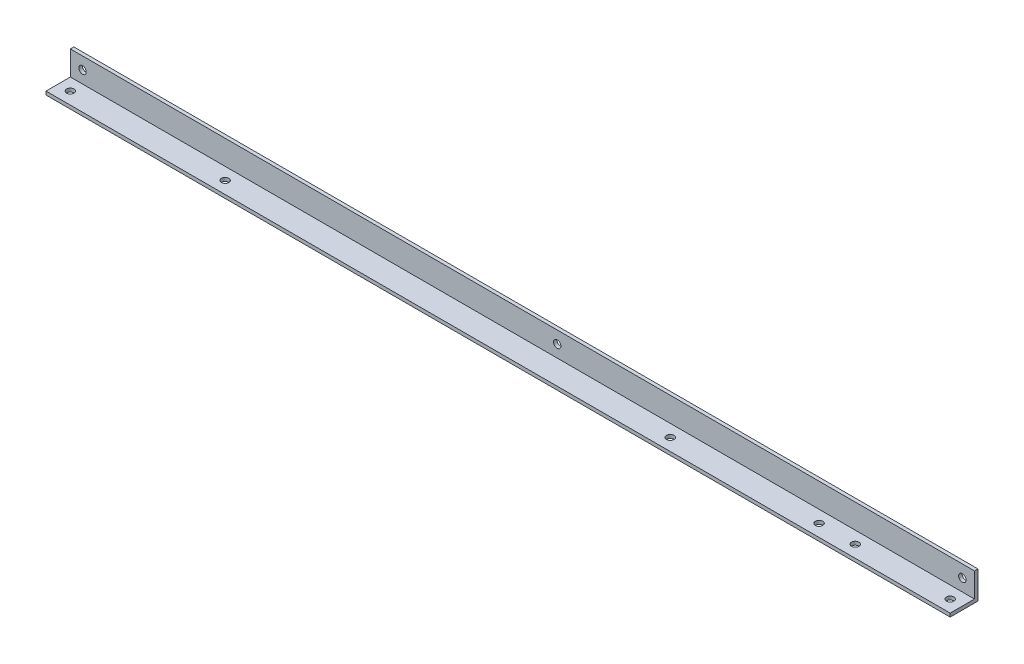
SolidWorks part; units mm, degrees
ref_plane "Front Plane" through (0, 0, 0) normal (0, 0, 1) x (1, 0, 0)
ref_plane "Top Plane" through (0, 0, 0) normal (0, 1, 0) x (1, 0, 0)
ref_plane "Right Plane" through (0, 0, 0) normal (1, 0, 0) x (0, 0, -1)
sketch "Sketch1" plane through (0, 0, 0) normal (0, 1, 0) x (1, 0, 0)
  line L1 (-412.75, 12.7) -> (412.75, 12.7)
  line L2 (-412.75, 12.7) -> (-412.75, -12.7)
  line L3 (-412.75, -12.7) -> (412.75, -12.7)
  line L4 (412.75, 12.7) -> (412.75, -12.7)
  line L5 (-412.75, 12.7) -> (412.75, -12.7) construction
  line L6 (-412.75, -12.7) -> (412.75, 12.7) construction
  point P0 (0, 0)
  dimension "D1" = 825.5
  dimension "D2" = 25.4
extrude "Boss-Extrude1" add sketch "Sketch1" along normal blind 3.175
sketch "Sketch2" plane through (0, 3.175, 0) normal (0, 1, 0) x (1, 0, 0)
  line L0 (-412.75, 12.7) -> (-412.75, 9.525)
  line L1 (-412.75, 12.7) -> (-412.75, -12.7) construction
  line L2 (-412.75, 9.525) -> (412.75, 9.525)
  line L3 (412.75, -12.7) -> (412.75, 12.7) construction
  line L4 (412.75, 9.525) -> (412.75, 12.7)
  line L5 (412.75, 12.7) -> (-412.75, 12.7)
  dimension "D1" = 3.175
extrude "Boss-Extrude2" add sketch "Sketch2" along normal blind 22.225
sketch "Sketch3" plane through (0, 3.175, 0) normal (0, 1, 0) x (1, 0, 0)
  line L0 (-412.75, -1.5875) -> (412.75, -1.5875) construction
  line L1 (-412.75, 9.525) -> (-412.75, -12.7) construction
  line L2 (412.75, -12.7) -> (412.75, 9.525) construction
  line L3 (-412.75, -12.7) -> (412.75, -12.7) construction
  circle A0 centre (-401.6375, -1.5875) radius 3.3782
  circle A1 centre (-260.35, -1.5875) radius 3.3782
  circle A2 centre (401.6375, -1.5875) radius 3.3782
  circle A3 centre (314.96, -1.5875) radius 3.3782
  circle A4 centre (146.05, -1.5875) radius 3.3782
  circle A5 centre (281.94, -1.5875) radius 3.3782
  dimension "D2" = 6.7564
  dimension "D3" = 6.7564
  dimension "D4" = 6.7564
  dimension "D5" = 6.7564
  dimension "D10" = 6.7564
  dimension "D12" = 6.7564
  dimension "D1" = 11.1125
  dimension "D6" = 11.1125
  dimension "D7" = 97.79
  dimension "D8" = 11.1125
  dimension "D9" = 33.02
  dimension "D11" = 152.4
  dimension "D13" = 558.8
extrude "Cut-Extrude1" cut sketch "Sketch3" against normal through all
sketch "Sketch4" plane through (0, 0, -9.525) normal (0, 0, 1) x (1, 0, 0)
  line L0 (-412.75, 14.2875) -> (412.75, 14.2875) construction
  line L1 (-412.75, 25.4) -> (-412.75, 3.175) construction
  line L2 (412.75, 25.4) -> (412.75, 3.175) construction
  line L3 (-412.75, 25.4) -> (412.75, 25.4) construction
  circle A0 centre (-401.6375, 14.2875) radius 3.3782
  circle A1 centre (401.6375, 14.2875) radius 3.3782
  circle A2 centre (31.75, 14.2875) radius 3.3782
  dimension "D2" = 6.7564
  dimension "D4" = 6.7564
  dimension "D5" = 6.7564
  dimension "D1" = 11.1125
  dimension "D3" = 11.1125
  dimension "D6" = 11.1125
  dimension "D7" = 381
extrude "Cut-Extrude2" cut sketch "Sketch4" against normal through all
